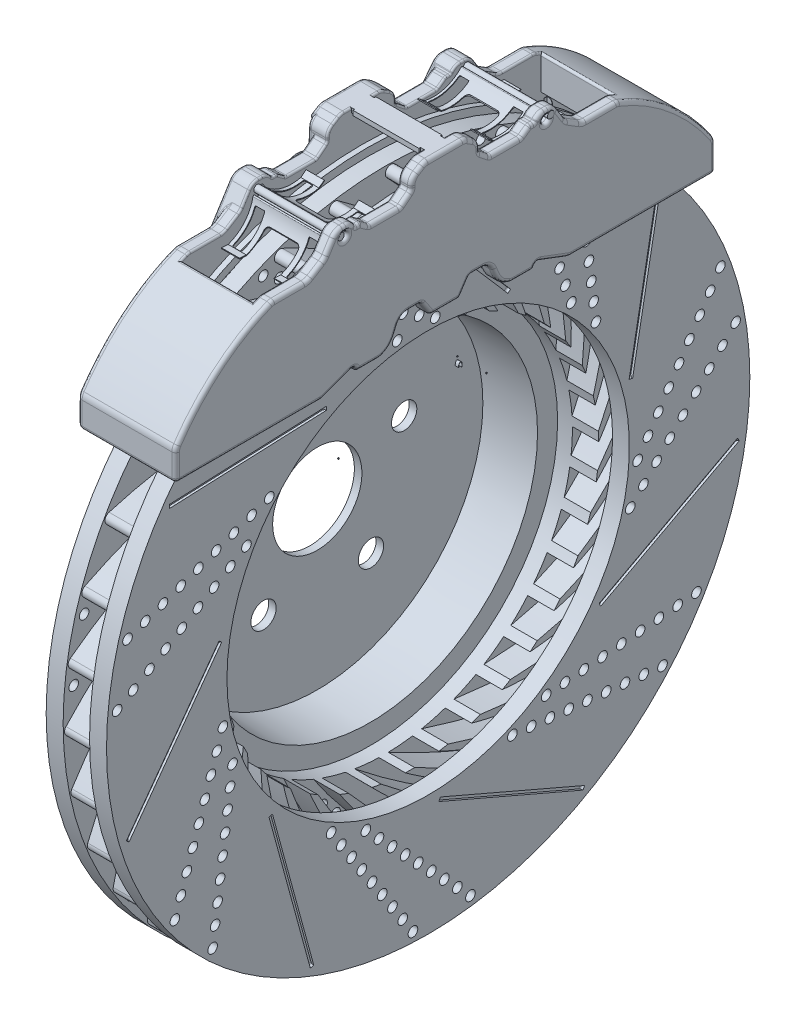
SolidWorks part; units mm, degrees
other "Mirror8[2]"
other "Body-Move/Copy1[4]"
other "Boss-Extrude31"
other "Boss-Extrude9"
other "Body-Move/Copy1[3]"
other "Mirror12"
other "Mirror11[3]"
other "Split Line2"
other "Boss-Extrude28"
other "Body-Move/Copy1[2]"
other "Mirror10"
other "Mirror11[2]"
other "Cut-Extrude19"
other "Fillet1"
other "Mirror11[1]"
other "Boss-Extrude25"
ref_plane "Front Plane" through (0, 0, 0) normal (0, 0, 1) x (1, 0, 0)
ref_plane "Top Plane" through (0, 0, 0) normal (0, 1, 0) x (1, 0, 0)
ref_plane "Right Plane" through (0, 0, 0) normal (1, 0, 0) x (0, 0, -1)
imported_body "Imported1"
imported_body "Imported2"
imported_body "Imported3"
imported_body "Imported4"
imported_body "Imported5"
imported_body "Imported6"
imported_body "Imported7"
imported_body "Imported8"
imported_body "Imported9"
imported_body "Imported10"
imported_body "Imported11"
imported_body "Imported12"
imported_body "Imported13"
imported_body "Imported14"
imported_body "Imported15"
imported_body "Imported16"
scale "Scale1" bodies to scale 104 106 110 115 107 114 112 109 101 113 108 scale about centroid uniform scaling yes scale factor 2.4
move or copy body "Body-Move/Copy1" bodies to move or copy 189 182 183 180 181 187 188 185 186 copy no translate (-4.9865, 105.3138, 0)
move or copy body "Body-Move/Copy2" bodies to move or copy 179 copy no translate (-26.1708, 0, 0)
move or copy body "Body-Move/Copy3" bodies to move or copy 214 copy no translate (3.7382, 26.7335, -39.8857)
move or copy body "Body-Move/Copy4" bodies to move or copy 216 copy no translate (3.2853, 25.9446, 39.7605)
move or copy body "Body-Move/Copy5" bodies to move or copy 217 copy no translate (4.9937, 21.3918, 38.5338)
move or copy body "Body-Move/Copy6" bodies to move or copy 215 copy no translate (3.7352, 23.7875, -39.1117)
move or copy body "Body-Move/Copy7" bodies to move or copy 213 copy no translate (-7.3653, 0, 0)
move or copy body "Body-Move/Copy8" bodies to move or copy 211 copy no translate (17.0773, 0, 0)
move or copy body "Body-Move/Copy9" bodies to move or copy 212 copy no translate (-4.5828, 0, 0)
move or copy body "Body-Move/Copy10" bodies to move or copy 210 copy no translate (15.1491, 0, 0)
ref_plane "Plane1" through (-73.4393, 0, 0) normal (-1, 0, 0) x (0, 0, 1)
sketch "Sketch1" plane through (-73.4393, 0, 0) normal (-1, 0, 0) x (0, 0, 1)
  text T0 "INFINITI" font "Copperplate Gothic Light" height in points 48
extrude "Cut-Extrude1" cut sketch "Sketch1" against normal blind 48
